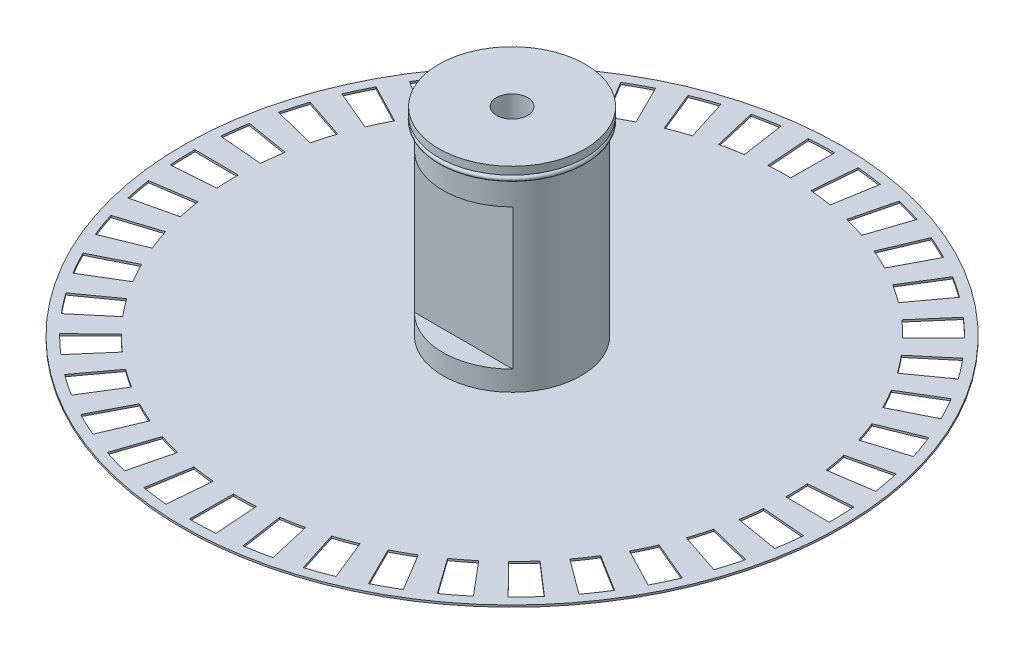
SolidWorks part; units mm, degrees
ref_plane "Plan de face" through (0, 0, 0) normal (0, 0, 1) x (1, 0, 0)
ref_plane "Plan de dessus" through (0, 0, 0) normal (0, 1, 0) x (1, 0, 0)
ref_plane "Plan de droite" through (0, 0, 0) normal (1, 0, 0) x (0, 0, -1)
sketch "Esquisse1" plane through (0, 0, 0) normal (0, 0, 1) x (1, 0, 0)
  line L0 (-1.6, 0) -> (-24, 0)
  line L1 (-24, 0) -> (-24, 1.6)
  line L2 (-24, 1.6) -> (-34, 1.6)
  line L3 (-34, 1.6) -> (-34, 1.8)
  line L4 (-34, 1.8) -> (-7.125, 1.8)
  line L5 (-7.125, 1.8) -> (-7.125, 20.94)
  line L6 (-7.125, 21.5) -> (-7.5562, 21.5)
  line L7 (-7.5562, 21.5) -> (-7.5562, 22.3)
  line L8 (-7.5562, 22.3) -> (-1.6, 22.3)
  line L9 (0, 0) -> (0, 63.0165) construction
  line L10 (-1.6, 22.3) -> (-1.6, 0)
  line L11 (-7.125, 21.24) -> (-7.125, 21.5)
  arc A0 (-7.125, 21.24) -> (-7.125, 20.94) centre (-7.325, 21.09) ccw
  dimension "D10" = 0.5
  dimension "D12" = 0.2
  dimension "D1" = 22.3
  dimension "D2" = 0.8
  dimension "D3" = 15.1125
  dimension "D4" = 14.25
  dimension "D5" = 20.5
  dimension "D6" = 0.2
  dimension "D7" = 48
  dimension "D8" = 68
  dimension "D9" = 3.2
  dimension "D11" = 1.21
revolve "Révolution1" add sketch "Esquisse1" angle 360 about L9
sketch "Esquisse2" plane through (0, 1.6, 0) normal (0, -1, 0) x (1, 0, 0)
  line L0 (0, 0) -> (0, 36.9763) construction
  line L1 (-0.2487, 28.4989) -> (-0.288, 32.9987)
  line L2 (4.2126, 28.187) -> (4.8777, 32.6375)
  line L3 (6.4596, 27.7583) -> (7.4795, 32.1412)
  line L4 (8.5701, 27.1809) -> (9.9233, 31.4727)
  line L5 (10.7224, 26.4061) -> (12.4154, 30.5754)
  line L6 (2.0377, 28.4271) -> (2.3594, 32.9155)
  line L7 (12.7166, 25.5056) -> (14.7245, 29.5328)
  line L8 (14.7212, 24.4036) -> (17.0456, 28.2568)
  line L9 (16.55, 23.2023) -> (19.1632, 26.8658)
  line L10 (18.3575, 21.8003) -> (21.2561, 25.2424)
  line L11 (19.9759, 20.3276) -> (23.13, 23.5373)
  line L12 (21.5418, 18.6601) -> (24.9432, 21.6064)
  line L13 (22.9099, 16.9524) -> (26.5273, 19.6292)
  line L14 (24.1957, 15.0605) -> (28.0161, 17.4385)
  line L15 (25.2798, 13.1598) -> (29.2714, 15.2377)
  line L16 (26.2538, 11.09) -> (30.3991, 12.8411)
  line L17 (27.0272, 9.0432) -> (31.2947, 10.4711)
  line L18 (27.6654, 6.8465) -> (32.0336, 7.9275)
  line L19 (28.1091, 4.7039) -> (32.5474, 5.4466)
  line L20 (28.3958, 2.4344) -> (32.8794, 2.8188)
  line L21 (28.4989, 0.2487) -> (32.9987, 0.288)
  line L22 (28.4271, -2.0377) -> (32.9155, -2.3594)
  line L23 (28.187, -4.2126) -> (32.6375, -4.8777)
  line L24 (27.7583, -6.4596) -> (32.1412, -7.4795)
  line L25 (27.1809, -8.5701) -> (31.4727, -9.9233)
  line L26 (26.4061, -10.7224) -> (30.5754, -12.4154)
  line L27 (25.5056, -12.7166) -> (29.5328, -14.7245)
  line L28 (24.4036, -14.7212) -> (28.2568, -17.0456)
  line L29 (23.2023, -16.55) -> (26.8658, -19.1632)
  line L30 (21.8003, -18.3575) -> (25.2424, -21.2561)
  line L31 (20.3276, -19.9759) -> (23.5373, -23.13)
  line L32 (18.6601, -21.5418) -> (21.6064, -24.9432)
  line L33 (16.9524, -22.9099) -> (19.6292, -26.5273)
  line L34 (15.0605, -24.1957) -> (17.4385, -28.0161)
  line L35 (13.1598, -25.2798) -> (15.2377, -29.2714)
  line L36 (11.09, -26.2538) -> (12.8411, -30.3991)
  line L37 (9.0432, -27.0272) -> (10.4711, -31.2947)
  line L38 (6.8465, -27.6654) -> (7.9275, -32.0336)
  line L39 (4.7039, -28.1091) -> (5.4466, -32.5474)
  line L40 (2.4344, -28.3958) -> (2.8188, -32.8794)
  line L41 (0.2487, -28.4989) -> (0.288, -32.9987)
  line L42 (-2.0377, -28.4271) -> (-2.3594, -32.9155)
  line L43 (-4.2126, -28.187) -> (-4.8777, -32.6375)
  line L44 (-6.4596, -27.7583) -> (-7.4795, -32.1412)
  line L45 (-8.5701, -27.1809) -> (-9.9233, -31.4727)
  line L46 (-10.7224, -26.4061) -> (-12.4154, -30.5754)
  line L47 (-12.7166, -25.5056) -> (-14.7245, -29.5328)
  line L48 (-14.7212, -24.4036) -> (-17.0456, -28.2568)
  line L49 (-16.55, -23.2023) -> (-19.1632, -26.8658)
  line L50 (-18.3575, -21.8003) -> (-21.2561, -25.2424)
  line L51 (-19.9759, -20.3276) -> (-23.13, -23.5373)
  line L52 (-21.5418, -18.6601) -> (-24.9432, -21.6064)
  line L53 (-22.9099, -16.9524) -> (-26.5273, -19.6292)
  line L54 (-24.1957, -15.0605) -> (-28.0161, -17.4385)
  line L55 (-25.2798, -13.1598) -> (-29.2714, -15.2377)
  line L56 (-26.2538, -11.09) -> (-30.3991, -12.8411)
  line L57 (-27.0272, -9.0432) -> (-31.2947, -10.4711)
  line L58 (-27.6654, -6.8465) -> (-32.0336, -7.9275)
  line L59 (-28.1091, -4.7039) -> (-32.5474, -5.4466)
  line L60 (-28.3958, -2.4344) -> (-32.8794, -2.8188)
  line L61 (-28.4989, -0.2487) -> (-32.9987, -0.288)
  line L62 (-28.4271, 2.0377) -> (-32.9155, 2.3594)
  line L63 (-28.187, 4.2126) -> (-32.6375, 4.8777)
  line L64 (-27.7583, 6.4596) -> (-32.1412, 7.4795)
  line L65 (-27.1809, 8.5701) -> (-31.4727, 9.9233)
  line L66 (-26.4061, 10.7224) -> (-30.5754, 12.4154)
  line L67 (-25.5056, 12.7166) -> (-29.5328, 14.7245)
  line L68 (-24.4036, 14.7212) -> (-28.2568, 17.0456)
  line L69 (-23.2023, 16.55) -> (-26.8658, 19.1632)
  line L70 (-21.8003, 18.3575) -> (-25.2424, 21.2561)
  line L71 (-20.3276, 19.9759) -> (-23.5373, 23.13)
  line L72 (-18.6601, 21.5418) -> (-21.6064, 24.9432)
  line L73 (-16.9524, 22.9099) -> (-19.6292, 26.5273)
  line L74 (-15.0605, 24.1957) -> (-17.4385, 28.0161)
  line L75 (-13.1598, 25.2798) -> (-15.2377, 29.2714)
  line L76 (-11.09, 26.2538) -> (-12.8411, 30.3991)
  line L77 (-9.0432, 27.0272) -> (-10.4711, 31.2947)
  line L78 (-6.8465, 27.6654) -> (-7.9275, 32.0336)
  line L79 (-4.7039, 28.1091) -> (-5.4466, 32.5474)
  line L80 (-2.4344, 28.3958) -> (-2.8188, 32.8794)
  arc A0 (2.0377, 28.4271) -> (-0.2487, 28.4989) centre (0, 0) ccw
  arc A1 (2.3594, 32.9155) -> (-0.288, 32.9987) centre (0, 0) ccw
  arc A2 (7.4795, 32.1412) -> (4.8777, 32.6375) centre (0, 0) ccw
  arc A3 (6.4596, 27.7583) -> (4.2126, 28.187) centre (0, 0) ccw
  arc A4 (12.4154, 30.5754) -> (9.9233, 31.4727) centre (0, 0) ccw
  arc A5 (10.7224, 26.4061) -> (8.5701, 27.1809) centre (0, 0) ccw
  arc A6 (17.0456, 28.2568) -> (14.7245, 29.5328) centre (0, 0) ccw
  arc A7 (14.7212, 24.4036) -> (12.7166, 25.5056) centre (0, 0) ccw
  arc A8 (21.2561, 25.2424) -> (19.1632, 26.8658) centre (0, 0) ccw
  arc A9 (18.3575, 21.8003) -> (16.55, 23.2023) centre (0, 0) ccw
  arc A10 (24.9432, 21.6064) -> (23.13, 23.5373) centre (0, 0) ccw
  arc A11 (21.5418, 18.6601) -> (19.9759, 20.3276) centre (0, 0) ccw
  arc A12 (28.0161, 17.4385) -> (26.5273, 19.6292) centre (0, 0) ccw
  arc A13 (24.1957, 15.0605) -> (22.9099, 16.9524) centre (0, 0) ccw
  arc A14 (30.3991, 12.8411) -> (29.2714, 15.2377) centre (0, 0) ccw
  arc A15 (26.2538, 11.09) -> (25.2798, 13.1598) centre (0, 0) ccw
  arc A16 (32.0336, 7.9275) -> (31.2947, 10.4711) centre (0, 0) ccw
  arc A17 (27.6654, 6.8465) -> (27.0272, 9.0432) centre (0, 0) ccw
  arc A18 (32.8794, 2.8188) -> (32.5474, 5.4466) centre (0, 0) ccw
  arc A19 (28.3958, 2.4344) -> (28.1091, 4.7039) centre (0, 0) ccw
  arc A20 (32.9155, -2.3594) -> (32.9987, 0.288) centre (0, 0) ccw
  arc A21 (28.4271, -2.0377) -> (28.4989, 0.2487) centre (0, 0) ccw
  arc A22 (32.1412, -7.4795) -> (32.6375, -4.8777) centre (0, 0) ccw
  arc A23 (27.7583, -6.4596) -> (28.187, -4.2126) centre (0, 0) ccw
  arc A24 (30.5754, -12.4154) -> (31.4727, -9.9233) centre (0, 0) ccw
  arc A25 (26.4061, -10.7224) -> (27.1809, -8.5701) centre (0, 0) ccw
  arc A26 (28.2568, -17.0456) -> (29.5328, -14.7245) centre (0, 0) ccw
  arc A27 (24.4036, -14.7212) -> (25.5056, -12.7166) centre (0, 0) ccw
  arc A28 (25.2424, -21.2561) -> (26.8658, -19.1632) centre (0, 0) ccw
  arc A29 (21.8003, -18.3575) -> (23.2023, -16.55) centre (0, 0) ccw
  arc A30 (21.6064, -24.9432) -> (23.5373, -23.13) centre (0, 0) ccw
  arc A31 (18.6601, -21.5418) -> (20.3276, -19.9759) centre (0, 0) ccw
  arc A32 (17.4385, -28.0161) -> (19.6292, -26.5273) centre (0, 0) ccw
  arc A33 (15.0605, -24.1957) -> (16.9524, -22.9099) centre (0, 0) ccw
  arc A34 (12.8411, -30.3991) -> (15.2377, -29.2714) centre (0, 0) ccw
  arc A35 (11.09, -26.2538) -> (13.1598, -25.2798) centre (0, 0) ccw
  arc A36 (7.9275, -32.0336) -> (10.4711, -31.2947) centre (0, 0) ccw
  arc A37 (6.8465, -27.6654) -> (9.0432, -27.0272) centre (0, 0) ccw
  arc A38 (2.8188, -32.8794) -> (5.4466, -32.5474) centre (0, 0) ccw
  arc A39 (2.4344, -28.3958) -> (4.7039, -28.1091) centre (0, 0) ccw
  arc A40 (-2.3594, -32.9155) -> (0.288, -32.9987) centre (0, 0) ccw
  arc A41 (-2.0377, -28.4271) -> (0.2487, -28.4989) centre (0, 0) ccw
  arc A42 (-7.4795, -32.1412) -> (-4.8777, -32.6375) centre (0, 0) ccw
  arc A43 (-6.4596, -27.7583) -> (-4.2126, -28.187) centre (0, 0) ccw
  arc A44 (-12.4154, -30.5754) -> (-9.9233, -31.4727) centre (0, 0) ccw
  arc A45 (-10.7224, -26.4061) -> (-8.5701, -27.1809) centre (0, 0) ccw
  arc A46 (-17.0456, -28.2568) -> (-14.7245, -29.5328) centre (0, 0) ccw
  arc A47 (-14.7212, -24.4036) -> (-12.7166, -25.5056) centre (0, 0) ccw
  arc A48 (-21.2561, -25.2424) -> (-19.1632, -26.8658) centre (0, 0) ccw
  arc A49 (-18.3575, -21.8003) -> (-16.55, -23.2023) centre (0, 0) ccw
  arc A50 (-24.9432, -21.6064) -> (-23.13, -23.5373) centre (0, 0) ccw
  arc A51 (-21.5418, -18.6601) -> (-19.9759, -20.3276) centre (0, 0) ccw
  arc A52 (-28.0161, -17.4385) -> (-26.5273, -19.6292) centre (0, 0) ccw
  arc A53 (-24.1957, -15.0605) -> (-22.9099, -16.9524) centre (0, 0) ccw
  arc A54 (-30.3991, -12.8411) -> (-29.2714, -15.2377) centre (0, 0) ccw
  arc A55 (-26.2538, -11.09) -> (-25.2798, -13.1598) centre (0, 0) ccw
  arc A56 (-32.0336, -7.9275) -> (-31.2947, -10.4711) centre (0, 0) ccw
  arc A57 (-27.6654, -6.8465) -> (-27.0272, -9.0432) centre (0, 0) ccw
  arc A58 (-32.8794, -2.8188) -> (-32.5474, -5.4466) centre (0, 0) ccw
  arc A59 (-28.3958, -2.4344) -> (-28.1091, -4.7039) centre (0, 0) ccw
  arc A60 (-32.9155, 2.3594) -> (-32.9987, -0.288) centre (0, 0) ccw
  arc A61 (-28.4271, 2.0377) -> (-28.4989, -0.2487) centre (0, 0) ccw
  arc A62 (-32.1412, 7.4795) -> (-32.6375, 4.8777) centre (0, 0) ccw
  arc A63 (-27.7583, 6.4596) -> (-28.187, 4.2126) centre (0, 0) ccw
  arc A64 (-30.5754, 12.4154) -> (-31.4727, 9.9233) centre (0, 0) ccw
  arc A65 (-26.4061, 10.7224) -> (-27.1809, 8.5701) centre (0, 0) ccw
  arc A66 (-28.2568, 17.0456) -> (-29.5328, 14.7245) centre (0, 0) ccw
  arc A67 (-24.4036, 14.7212) -> (-25.5056, 12.7166) centre (0, 0) ccw
  arc A68 (-25.2424, 21.2561) -> (-26.8658, 19.1632) centre (0, 0) ccw
  arc A69 (-21.8003, 18.3575) -> (-23.2023, 16.55) centre (0, 0) ccw
  arc A70 (-21.6064, 24.9432) -> (-23.5373, 23.13) centre (0, 0) ccw
  arc A71 (-18.6601, 21.5418) -> (-20.3276, 19.9759) centre (0, 0) ccw
  arc A72 (-17.4385, 28.0161) -> (-19.6292, 26.5273) centre (0, 0) ccw
  arc A73 (-15.0605, 24.1957) -> (-16.9524, 22.9099) centre (0, 0) ccw
  arc A74 (-12.8411, 30.3991) -> (-15.2377, 29.2714) centre (0, 0) ccw
  arc A75 (-11.09, 26.2538) -> (-13.1598, 25.2798) centre (0, 0) ccw
  arc A76 (-7.9275, 32.0336) -> (-10.4711, 31.2947) centre (0, 0) ccw
  arc A77 (-6.8465, 27.6654) -> (-9.0432, 27.0272) centre (0, 0) ccw
  arc A78 (-2.8188, 32.8794) -> (-5.4466, 32.5474) centre (0, 0) ccw
  arc A79 (-2.4344, 28.3958) -> (-4.7039, 28.1091) centre (0, 0) ccw
  point P166 (0, 0)
  dimension "D1" = 40
  dimension "D2" = 57
extrude "Enlèv. mat.-Extru.1" cut sketch "Esquisse2" against normal through all
ref_plane "Plan1" through (0, 0, 10) normal (0, 0, 1) x (1, 0, 0)
sketch "Esquisse3" plane through (0, 0, 10) normal (0, 0, 1) x (1, 0, 0)
  line L1 (-11.5568, 18.3623) -> (11.5233, 18.3623)
  line L2 (-11.5568, 18.3623) -> (-11.5568, 3.8733)
  line L3 (-11.5568, 3.8733) -> (11.5233, 3.8733)
  line L4 (11.5233, 18.3623) -> (11.5233, 3.8733)
extrude "Enlèv. mat.-Extru.2" cut sketch "Esquisse3" against normal blind 5
